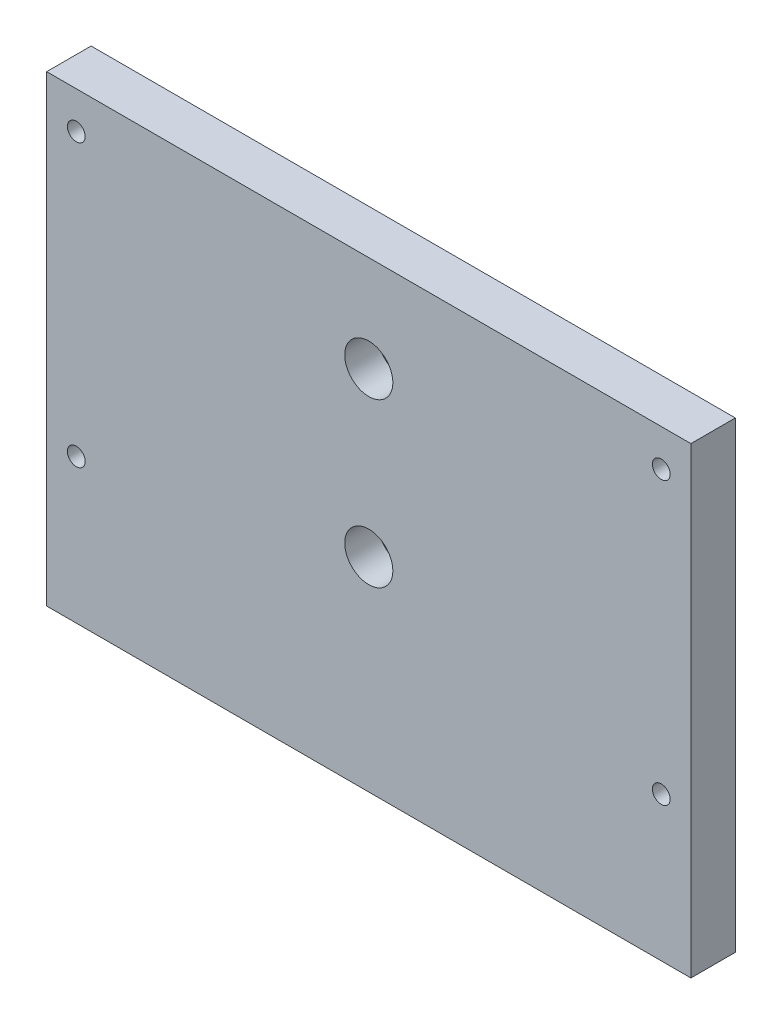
SolidWorks part; units mm, degrees
ref_plane "Face" through (0, 0, 0) normal (0, 0, 1) x (1, 0, 0)
ref_plane "Dessus" through (0, 0, 0) normal (0, 1, 0) x (1, 0, 0)
ref_plane "Droite" through (0, 0, 0) normal (1, 0, 0) x (0, 0, -1)
sketch "Esquisse1" plane through (0, 0, 0) normal (0, 0, 1) x (1, 0, 0)
  line L1 (-87, 62.5) -> (87, 62.5)
  line L2 (-87, 62.5) -> (-87, -62.5)
  line L3 (-87, -62.5) -> (87, -62.5)
  line L4 (87, 62.5) -> (87, -62.5)
  dimension "D1" = 174
  dimension "D2" = 125
  dimension "D3" = 87
  dimension "D4" = 62.5
extrude "Extrusion1" add sketch "Esquisse1" along normal blind 12
hole_wizard "Chambrage pour vis à tête cylindrique fendue M61" positions "Esquisse3" profile "Esquisse2" counterbore size "M6" standard "ISO"
sketch "Esquisse3" plane through (0, 0, 12) normal (0, 0, 1) x (1, 0, 0)
  line L0 (0, 65.4872) -> (0, -46.5085) construction
  line L1 (87, 62.5) -> (-87, 62.5) construction
  point P0 (0, -7.5)
  point P1 (0, 36.5)
  dimension "D1" = 26
  dimension "D2" = 70
sketch "Esquisse2" plane through (0, -7.5, 12) normal (1, 0, 0) x (0, -1, 0)
  line L0 (0, 0) -> (0, 12)
  line L1 (0, 12) -> (3.3, 12)
  line L3 (3.3, 12) -> (3.3, 9)
  line L4 (3.3, 9) -> (6.5, 9)
  line L5 (6.5, 9) -> (6.5, 0)
  line L7 (6.5, 0) -> (0, 0)
  line L11 (0, -6.35) -> (0, 107.95) construction
  dimension "Diamètre du perçage jusqu'au prochain" = 6.6
  dimension "Profondeur du perçage jusqu'au prochain" = 12
  dimension "Diamètre du chambrage" = 13
  dimension "Profondeur du chambrage" = 9
hole_wizard "Trou taraudé M6x1.01" positions "Esquisse5" profile "Esquisse4" tap size "M6x1.0" standard "ISO"
sketch "Esquisse5" plane through (0, 0, 12) normal (0, 0, 1) x (1, 0, 0)
  line L0 (79, 77.8592) -> (79, -61.053) construction
  line L1 (-79, 79.7362) -> (-79, -58.7463) construction
  line L2 (87, 62.5) -> (-87, 62.5) construction
  line L3 (-87, -62.5) -> (87, -62.5) construction
  line L4 (87, -62.5) -> (87, 62.5) construction
  line L5 (-87, 62.5) -> (-87, -62.5) construction
  point P0 (-79, -23.5)
  point P1 (-79, 52.5)
  point P2 (79, -23.5)
  point P3 (79, 52.5)
  dimension "D1" = 10
  dimension "D2" = 39
  dimension "D3" = 8
  dimension "D4" = 10
  dimension "D5" = 39
  dimension "D6" = 8
sketch "Esquisse4" plane through (-79, -23.5, 12) normal (1, 0, 0) x (0, -1, 0)
  line L0 (0, 0) -> (0, 12)
  line L1 (0, 12) -> (2.4, 12)
  line L2 (2.4, 12) -> (2.4, 0)
  line L5 (2.4, 0) -> (0, 0)
  line L11 (0, -6.35) -> (0, 107.95) construction
  dimension "Diamètre du trou pour taraudage jusqu'au prochain" = 4.8
  dimension "Profondeur du trou pour taraudage jusqu'au prochain" = 12
hole_wizard "Trou taraudé M6x1.02" positions "Esquisse7" profile "Esquisse6" tap size "M6x1.0" standard "ISO"
sketch "Esquisse7" plane through (-87, 0, 0) normal (-1, 0, 0) x (0, 0, 1)
  line L0 (6, 67.0869) -> (6, -68.2502) construction
  line L1 (12, 62.5) -> (12, -62.5) construction
  line L2 (12, 62.5) -> (0, 62.5) construction
  point P0 (6, 36.5)
  point P1 (6, -7.5)
  dimension "D1" = 6
  dimension "D2" = 26
  dimension "D3" = 70
sketch "Esquisse6" plane through (-87, 36.5, 6) normal (0, 1, 0) x (0, 0, 1)
  line L0 (0, 0) -> (0, 31.4421)
  line L1 (0, 31.4421) -> (2.4, 30)
  line L2 (2.4, 30) -> (2.4, 0)
  line L5 (2.4, 0) -> (0, 0)
  line L10 (0, 31.4421) -> (-2.4, 30) construction
  line L11 (0, -6.35) -> (0, 107.95) construction
  dimension "Diamètre du trou pour taraudage" = 4.8
  dimension "Profondeur du trou pour taraudage" = 30
  dimension "Angle de pointe" = 118
